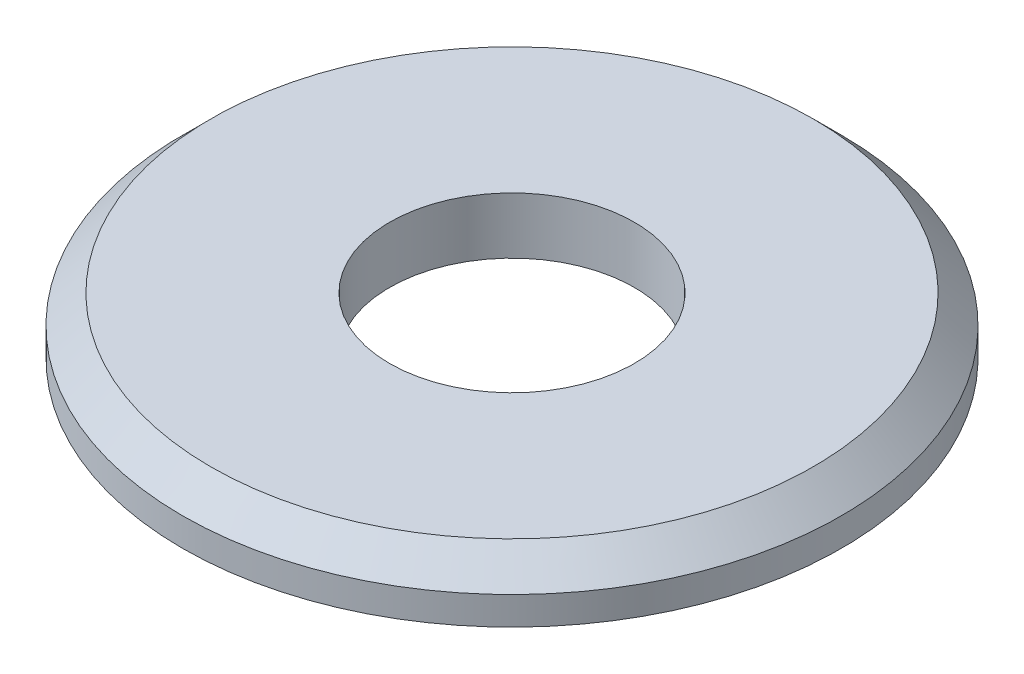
SolidWorks part; units mm, degrees
ref_plane "Front" through (0, 0, 0) normal (0, 0, 1) x (1, 0, 0)
ref_plane "Top" through (0, 0, 0) normal (0, 1, 0) x (1, 0, 0)
ref_plane "Right" through (0, 0, 0) normal (1, 0, 0) x (0, 0, -1)
sketch "Sketch1" plane through (0, 0, 0) normal (0, 1, 0) x (1, 0, 0)
  circle A0 centre (0, 0) radius 0.65
  circle A1 centre (0, 0) radius 1.75
extrude "Extrude1" add sketch "Sketch1" along normal blind 0.3
chamfer "Chamfer1" distance 0.15 1 edges at (0, 0.3, 1.75)
